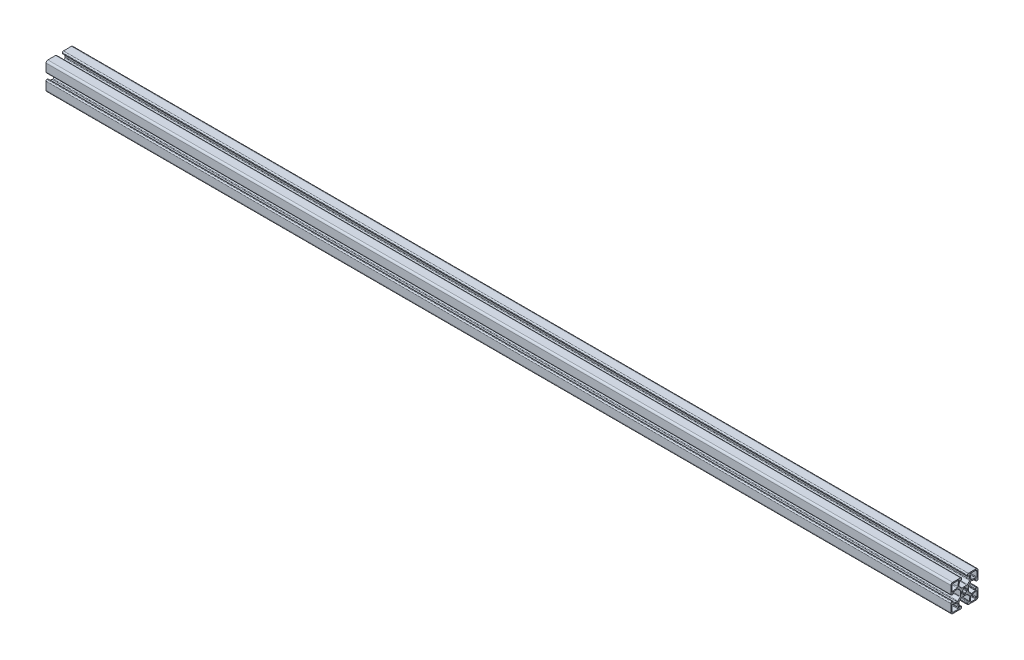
SolidWorks part; units mm, degrees
ref_plane "正面" through (0, 0, 0) normal (0, 0, 1) x (1, 0, 0)
ref_plane "平面" through (0, 0, 0) normal (0, 1, 0) x (1, 0, 0)
ref_plane "右側面" through (0, 0, 0) normal (1, 0, 0) x (0, 0, -1)
sketch "ｽｹｯﾁ1" plane through (0, 0, 0) normal (1, 0, 0) x (0, 0, -1)
  line L72 (-12.4515, -13.82) -> (-6.6497, -13.82)
  line L73 (-6.5293, -12.2917) -> (-7.2691, -8.0964)
  line L74 (-8.0964, -7.2691) -> (-12.2917, -6.5293)
  line L75 (-13.82, -6.6497) -> (-13.82, -12.4515)
  line L76 (12.4515, 13.82) -> (6.6497, 13.82)
  line L77 (6.5293, 12.2917) -> (7.2691, 8.0964)
  line L78 (8.0964, 7.2691) -> (12.2917, 6.5293)
  line L79 (13.82, 6.6497) -> (13.82, 12.4515)
  line L80 (-13.82, 12.4515) -> (-13.82, 6.6497)
  line L81 (-12.2917, 6.5293) -> (-8.0964, 7.2691)
  line L82 (-7.2691, 8.0964) -> (-6.5293, 12.2917)
  line L83 (-6.6497, 13.82) -> (-12.4515, 13.82)
  line L84 (13.8, -3.15) -> (13.15, -3.15)
  line L85 (15, -13) -> (15, -4.35)
  line L86 (4.35, -15) -> (13, -15)
  line L87 (3.15, -13.15) -> (3.15, -13.8)
  line L88 (4.8925, -12.4) -> (3.9, -12.4)
  line L89 (6.0721, -8.0894) -> (5.3849, -11.9868)
  line L90 (3.3787, -4.7929) -> (5.7944, -7.2086)
  line L91 (-2.6716, -4.5) -> (2.6716, -4.5)
  line L92 (-5.7944, -7.2086) -> (-3.3787, -4.7929)
  line L93 (-5.3849, -11.9868) -> (-6.0721, -8.0894)
  line L94 (-3.9, -12.4) -> (-4.8925, -12.4)
  line L95 (-3.15, -13.8) -> (-3.15, -13.15)
  line L96 (-13, -15) -> (-4.35, -15)
  line L97 (-15, -4.35) -> (-15, -13)
  line L98 (-13.15, -3.15) -> (-13.8, -3.15)
  line L99 (-12.4, -4.8925) -> (-12.4, -3.9)
  line L100 (-8.0894, -6.0721) -> (-11.9868, -5.3849)
  line L101 (-4.7929, -3.3787) -> (-7.2086, -5.7944)
  line L102 (-4.5, 2.6716) -> (-4.5, -2.6716)
  line L103 (-7.2086, 5.7944) -> (-4.7929, 3.3787)
  line L104 (-11.9868, 5.3849) -> (-8.0894, 6.0721)
  line L105 (-12.4, 3.9) -> (-12.4, 4.8925)
  line L106 (-13.8, 3.15) -> (-13.15, 3.15)
  line L107 (-15, 13) -> (-15, 4.35)
  line L108 (-4.35, 15) -> (-13, 15)
  line L109 (-3.15, 13.15) -> (-3.15, 13.8)
  line L110 (-4.8925, 12.4) -> (-3.9, 12.4)
  line L111 (-6.0721, 8.0894) -> (-5.3849, 11.9868)
  line L112 (-3.3787, 4.7929) -> (-5.7944, 7.2086)
  line L113 (2.6716, 4.5) -> (-2.6716, 4.5)
  line L114 (5.7944, 7.2086) -> (3.3787, 4.7929)
  line L115 (5.3849, 11.9868) -> (6.0721, 8.0894)
  line L116 (3.9, 12.4) -> (4.8925, 12.4)
  line L117 (3.15, 13.8) -> (3.15, 13.15)
  line L118 (13, 15) -> (4.35, 15)
  line L119 (15, 4.35) -> (15, 13)
  line L120 (13.15, 3.15) -> (13.8, 3.15)
  line L121 (12.4, 4.8925) -> (12.4, 3.9)
  line L122 (8.0894, 6.0721) -> (11.9868, 5.3849)
  line L123 (4.7929, 3.3787) -> (7.2086, 5.7944)
  line L124 (4.5, -2.6716) -> (4.5, 2.6716)
  line L125 (7.2086, -5.7944) -> (4.7929, -3.3787)
  line L126 (11.9868, -5.3849) -> (8.0894, -6.0721)
  line L127 (12.4, -3.9) -> (12.4, -4.8925)
  line L128 (1, 2.6557) -> (1, 3)
  line L129 (0.5, 3.5) -> (-0.5, 3.5)
  line L130 (-1, 3) -> (-1, 2.6557)
  line L131 (-2.6557, 1) -> (-3, 1)
  line L132 (-3.5, 0.5) -> (-3.5, -0.5)
  line L133 (-3, -1) -> (-2.6557, -1)
  line L134 (-1, -2.6557) -> (-1, -3)
  line L135 (-0.5, -3.5) -> (0.5, -3.5)
  line L136 (1, -3) -> (1, -2.6557)
  line L137 (2.6557, -1) -> (3, -1)
  line L138 (3.5, -0.5) -> (3.5, 0.5)
  line L139 (3, 1) -> (2.6557, 1)
  line L140 (13.82, -12.4515) -> (13.82, -6.6497)
  line L141 (12.2917, -6.5293) -> (8.0964, -7.2691)
  line L142 (7.2691, -8.0964) -> (6.5293, -12.2917)
  line L143 (6.6497, -13.82) -> (12.4515, -13.82)
  arc A86 (-13.82, -12.4515) -> (-13.2674, -12.9705) centre (-13.3, -12.4515) ccw
  arc A87 (-12.9705, -13.2674) -> (-13.2674, -12.9705) centre (-13.2499, -13.2499) ccw
  arc A88 (-12.9705, -13.2674) -> (-12.4515, -13.82) centre (-12.4515, -13.3) ccw
  arc A89 (-6.6497, -13.82) -> (-6.2302, -12.9927) centre (-6.6497, -13.3) ccw
  arc A90 (-6.5293, -12.2917) -> (-6.2302, -12.9927) centre (-4.8748, -12) ccw
  arc A91 (-7.2691, -8.0964) -> (-8.0964, -7.2691) centre (-8.2736, -8.2736) ccw
  arc A92 (-12.9927, -6.2302) -> (-12.2917, -6.5293) centre (-12, -4.8748) ccw
  arc A93 (-12.9927, -6.2302) -> (-13.82, -6.6497) centre (-13.3, -6.6497) ccw
  arc A94 (13.82, 12.4515) -> (13.2674, 12.9705) centre (13.3, 12.4515) ccw
  arc A95 (12.9705, 13.2674) -> (13.2674, 12.9705) centre (13.2499, 13.2499) ccw
  arc A96 (12.9705, 13.2674) -> (12.4515, 13.82) centre (12.4515, 13.3) ccw
  arc A97 (6.6497, 13.82) -> (6.2302, 12.9927) centre (6.6497, 13.3) ccw
  arc A98 (6.5293, 12.2917) -> (6.2302, 12.9927) centre (4.8748, 12) ccw
  arc A99 (7.2691, 8.0964) -> (8.0964, 7.2691) centre (8.2736, 8.2736) ccw
  arc A100 (12.9927, 6.2302) -> (12.2917, 6.5293) centre (12, 4.8748) ccw
  arc A101 (12.9927, 6.2302) -> (13.82, 6.6497) centre (13.3, 6.6497) ccw
  arc A102 (-12.4515, 13.82) -> (-12.9705, 13.2674) centre (-12.4515, 13.3) ccw
  arc A103 (-13.2674, 12.9705) -> (-12.9705, 13.2674) centre (-13.2499, 13.2499) ccw
  arc A104 (-13.2674, 12.9705) -> (-13.82, 12.4515) centre (-13.3, 12.4515) ccw
  arc A105 (-13.82, 6.6497) -> (-12.9927, 6.2302) centre (-13.3, 6.6497) ccw
  arc A106 (-12.2917, 6.5293) -> (-12.9927, 6.2302) centre (-12, 4.8748) ccw
  arc A107 (-8.0964, 7.2691) -> (-7.2691, 8.0964) centre (-8.2736, 8.2736) ccw
  arc A108 (-6.2302, 12.9927) -> (-6.5293, 12.2917) centre (-4.8748, 12) ccw
  arc A109 (-6.2302, 12.9927) -> (-6.6497, 13.82) centre (-6.6497, 13.3) ccw
  arc A110 (15, -4.35) -> (13.8, -3.15) centre (13.8, -4.35) ccw
  arc A111 (13, -15) -> (15, -13) centre (13, -13) ccw
  arc A112 (3.15, -13.8) -> (4.35, -15) centre (4.35, -13.8) ccw
  arc A113 (3.9, -12.4) -> (3.15, -13.15) centre (3.9, -13.15) ccw
  arc A114 (4.8925, -12.4) -> (5.3849, -11.9868) centre (4.8925, -11.9) ccw
  arc A115 (6.0721, -8.0894) -> (5.7944, -7.2086) centre (5.0873, -7.9157) ccw
  arc A116 (3.3787, -4.7929) -> (2.6716, -4.5) centre (2.6716, -5.5) ccw
  arc A117 (-2.6716, -4.5) -> (-3.3787, -4.7929) centre (-2.6716, -5.5) ccw
  arc A118 (-5.7944, -7.2086) -> (-6.0721, -8.0894) centre (-5.0873, -7.9157) ccw
  arc A119 (-5.3849, -11.9868) -> (-4.8925, -12.4) centre (-4.8925, -11.9) ccw
  arc A120 (-3.15, -13.15) -> (-3.9, -12.4) centre (-3.9, -13.15) ccw
  arc A121 (-4.35, -15) -> (-3.15, -13.8) centre (-4.35, -13.8) ccw
  arc A122 (-15, -13) -> (-13, -15) centre (-13, -13) ccw
  arc A123 (-13.8, -3.15) -> (-15, -4.35) centre (-13.8, -4.35) ccw
  arc A124 (-12.4, -3.9) -> (-13.15, -3.15) centre (-13.15, -3.9) ccw
  arc A125 (-12.4, -4.8925) -> (-11.9868, -5.3849) centre (-11.9, -4.8925) ccw
  arc A126 (-8.0894, -6.0721) -> (-7.2086, -5.7944) centre (-7.9157, -5.0873) ccw
  arc A127 (-4.7929, -3.3787) -> (-4.5, -2.6716) centre (-5.5, -2.6716) ccw
  arc A128 (-4.5, 2.6716) -> (-4.7929, 3.3787) centre (-5.5, 2.6716) ccw
  arc A129 (-7.2086, 5.7944) -> (-8.0894, 6.0721) centre (-7.9157, 5.0873) ccw
  arc A130 (-11.9868, 5.3849) -> (-12.4, 4.8925) centre (-11.9, 4.8925) ccw
  arc A131 (-13.15, 3.15) -> (-12.4, 3.9) centre (-13.15, 3.9) ccw
  arc A132 (-15, 4.35) -> (-13.8, 3.15) centre (-13.8, 4.35) ccw
  arc A133 (-13, 15) -> (-15, 13) centre (-13, 13) ccw
  arc A134 (-3.15, 13.8) -> (-4.35, 15) centre (-4.35, 13.8) ccw
  arc A135 (-3.9, 12.4) -> (-3.15, 13.15) centre (-3.9, 13.15) ccw
  arc A136 (-4.8925, 12.4) -> (-5.3849, 11.9868) centre (-4.8925, 11.9) ccw
  arc A137 (-6.0721, 8.0894) -> (-5.7944, 7.2086) centre (-5.0873, 7.9157) ccw
  arc A138 (-3.3787, 4.7929) -> (-2.6716, 4.5) centre (-2.6716, 5.5) ccw
  arc A139 (2.6716, 4.5) -> (3.3787, 4.7929) centre (2.6716, 5.5) ccw
  arc A140 (5.7944, 7.2086) -> (6.0721, 8.0894) centre (5.0873, 7.9157) ccw
  arc A141 (5.3849, 11.9868) -> (4.8925, 12.4) centre (4.8925, 11.9) ccw
  arc A142 (3.15, 13.15) -> (3.9, 12.4) centre (3.9, 13.15) ccw
  arc A143 (4.35, 15) -> (3.15, 13.8) centre (4.35, 13.8) ccw
  arc A144 (15, 13) -> (13, 15) centre (13, 13) ccw
  arc A145 (13.8, 3.15) -> (15, 4.35) centre (13.8, 4.35) ccw
  arc A146 (12.4, 3.9) -> (13.15, 3.15) centre (13.15, 3.9) ccw
  arc A147 (12.4, 4.8925) -> (11.9868, 5.3849) centre (11.9, 4.8925) ccw
  arc A148 (8.0894, 6.0721) -> (7.2086, 5.7944) centre (7.9157, 5.0873) ccw
  arc A149 (4.7929, 3.3787) -> (4.5, 2.6716) centre (5.5, 2.6716) ccw
  arc A150 (4.5, -2.6716) -> (4.7929, -3.3787) centre (5.5, -2.6716) ccw
  arc A151 (7.2086, -5.7944) -> (8.0894, -6.0721) centre (7.9157, -5.0873) ccw
  arc A152 (11.9868, -5.3849) -> (12.4, -4.8925) centre (11.9, -4.8925) ccw
  arc A153 (13.15, -3.15) -> (12.4, -3.9) centre (13.15, -3.9) ccw
  arc A154 (2.2203, 1.2541) -> (2.6557, 1) centre (2.6557, 1.5) ccw
  arc A155 (2.2203, 1.2541) -> (1.2541, 2.2203) centre (0, 0) ccw
  arc A156 (1, 2.6557) -> (1.2541, 2.2203) centre (1.5, 2.6557) ccw
  arc A157 (1, 3) -> (0.5, 3.5) centre (0.5, 3) ccw
  arc A158 (-0.5, 3.5) -> (-1, 3) centre (-0.5, 3) ccw
  arc A159 (-1.2541, 2.2203) -> (-1, 2.6557) centre (-1.5, 2.6557) ccw
  arc A160 (-1.2541, 2.2203) -> (-2.2203, 1.2541) centre (0, 0) ccw
  arc A161 (-2.6557, 1) -> (-2.2203, 1.2541) centre (-2.6557, 1.5) ccw
  arc A162 (-3, 1) -> (-3.5, 0.5) centre (-3, 0.5) ccw
  arc A163 (-3.5, -0.5) -> (-3, -1) centre (-3, -0.5) ccw
  arc A164 (-2.2203, -1.2541) -> (-2.6557, -1) centre (-2.6557, -1.5) ccw
  arc A165 (-2.2203, -1.2541) -> (-1.2541, -2.2203) centre (0, 0) ccw
  arc A166 (-1, -2.6557) -> (-1.2541, -2.2203) centre (-1.5, -2.6557) ccw
  arc A167 (-1, -3) -> (-0.5, -3.5) centre (-0.5, -3) ccw
  arc A168 (0.5, -3.5) -> (1, -3) centre (0.5, -3) ccw
  arc A169 (1.2541, -2.2203) -> (1, -2.6557) centre (1.5, -2.6557) ccw
  arc A170 (1.2541, -2.2203) -> (2.2203, -1.2541) centre (0, 0) ccw
  arc A171 (2.6557, -1) -> (2.2203, -1.2541) centre (2.6557, -1.5) ccw
  arc A172 (3, -1) -> (3.5, -0.5) centre (3, -0.5) ccw
  arc A173 (3.5, 0.5) -> (3, 1) centre (3, 0.5) ccw
  arc A174 (12.4515, -13.82) -> (12.9705, -13.2674) centre (12.4515, -13.3) ccw
  arc A175 (13.2674, -12.9705) -> (12.9705, -13.2674) centre (13.2499, -13.2499) ccw
  arc A176 (13.2674, -12.9705) -> (13.82, -12.4515) centre (13.3, -12.4515) ccw
  arc A177 (13.82, -6.6497) -> (12.9927, -6.2302) centre (13.3, -6.6497) ccw
  arc A178 (12.2917, -6.5293) -> (12.9927, -6.2302) centre (12, -4.8748) ccw
  arc A179 (8.0964, -7.2691) -> (7.2691, -8.0964) centre (8.2736, -8.2736) ccw
  arc A180 (6.2302, -12.9927) -> (6.5293, -12.2917) centre (4.8748, -12) ccw
  arc A181 (6.2302, -12.9927) -> (6.6497, -13.82) centre (6.6497, -13.3) ccw
extrude "ﾎﾞｽ - 押し出し1" add sketch "ｽｹｯﾁ1" along normal blind 1000
